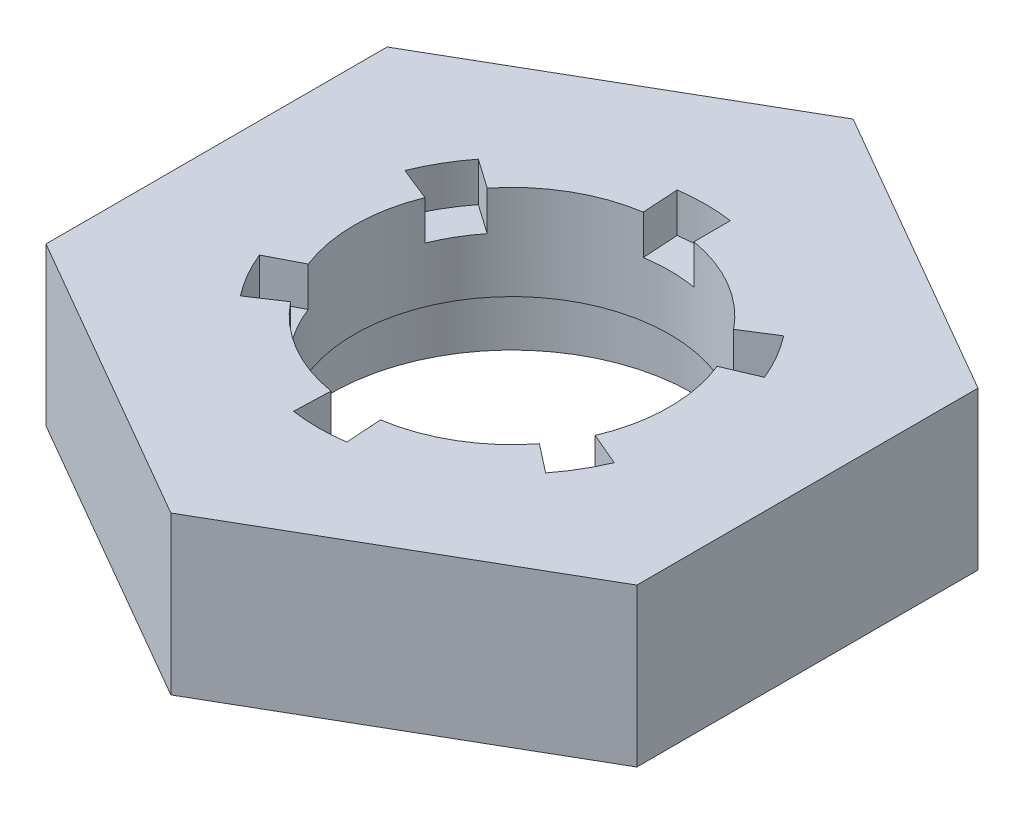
SolidWorks part; units mm, degrees
ref_plane "Front Plane" through (0, 0, 0) normal (0, 0, 1) x (1, 0, 0)
ref_plane "Top Plane" through (0, 0, 0) normal (0, 1, 0) x (1, 0, 0)
ref_plane "Right Plane" through (0, 0, 0) normal (1, 0, 0) x (0, 0, -1)
sketch "Sketch1" plane through (0, 0, 0) normal (0, 1, 0) x (1, 0, 0)
  line L0 (31.25, 32.475) -> (45.4247, 32.475)
  line L1 (75, 32.475) -> (75, 52.45)
  line L2 (75, 97.425) -> (68.75, 97.425)
  line L4 (0, 97.425) -> (0, 77.45)
  line L5 (0, 32.475) -> (6.25, 32.475)
  line L6 (56.25, 54.1247) -> (56.25, 75.7753)
  line L7 (18.75, 54.1247) -> (18.75, 75.7753)
  line L8 (0, 52.45) -> (0, 32.475)
  line L9 (18.75, 54.1247) -> (37.5, 43.2994)
  line L10 (37.5, 43.2994) -> (56.25, 54.1247)
  line L11 (56.25, 54.1247) -> (56.25, 75.7753)
  line L12 (56.25, 75.7753) -> (37.5, 86.6006)
  line L13 (37.5, 86.6006) -> (18.75, 75.7753)
  line L14 (18.75, 75.7753) -> (18.75, 54.1247)
  line L15 (68.75, 32.475) -> (75, 32.475)
  line L16 (75, 77.45) -> (75, 97.425)
  line L17 (43.75, 97.425) -> (31.25, 97.425)
  line L18 (6.25, 97.425) -> (0, 97.425)
  line L20 (29.1713, 39.3776) -> (17.9828, 44.9514)
  line L21 (56.25, 44.975) -> (45.4247, 38.725)
  line L28 (63.7858, 70.4718) -> (64.6108, 57.9991)
  line L38 (45.4247, 91.175) -> (56.25, 84.925)
  line L39 (18.75, 84.925) -> (29.5753, 91.175)
  line L45 (7.9042, 32.475) -> (7.9247, 32.475)
  line L49 (10.8253, 58.7) -> (10.8253, 71.2)
  circle A0 centre (37.5, 64.95) radius 10
  arc A3 (0, 52.45) -> (0, 77.45) centre (0, 64.95) ccw
  circle A4 centre (37.5, 64.95) radius 12.5
  arc A5 (75, 77.45) -> (75, 52.45) centre (75, 64.95) ccw
  arc A9 (6.25, 97.425) -> (31.25, 97.425) centre (18.75, 97.425) ccw
  arc A10 (43.75, 97.425) -> (68.75, 97.425) centre (56.25, 97.425) ccw
  arc A12 (31.25, 32.475) -> (6.25, 32.475) centre (18.75, 32.475) ccw
  arc A13 (68.75, 32.475) -> (43.75, 32.475) centre (56.25, 32.475) ccw
  circle A18 centre (18.75, -32.475) radius 12.5
  circle A19 centre (56.25, -32.475) radius 12.5
  circle A20 centre (93.75, -32.475) radius 12.5
  circle A21 centre (75, 0) radius 12.5
  circle A22 centre (37.5, 0) radius 12.5
  circle A23 centre (0, 0) radius 12.5
  circle A24 centre (0, 129.9) radius 12.5
  circle A25 centre (37.5, 129.9) radius 12.5
  circle A26 centre (75, 129.9) radius 12.5
  circle A27 centre (93.75, 97.425) radius 12.5
  circle A28 centre (93.75, 32.475) radius 12.5
  dimension "D1" = 3
  dimension "D3" = 3
  dimension "D2" = 3
  dimension "D4" = 3
extrude "Boss-Extrude6" add sketch "Sketch1" along normal blind 10 contours A4 A0 | L12 L13 L7 L9 L10 L6 A4
sketch "Sketch10" plane through (0, 0, 0) normal (0, -1, 0) x (1, 0, 0)
  circle A0 centre (37.5, -64.95) radius 11.5
extrude "Cut-Extrude2" cut sketch "Sketch10" against normal blind 4
sketch "Sketch13" plane through (0, 10, 0) normal (0, 1, 0) x (1, 0, 0)
  line L3 (48.8051, 60.1318) -> (46.6993, 61.0293)
  line L9 (47.1907, 57.3928) -> (45.3856, 58.8005)
  line L10 (35.9507, 74.8293) -> (35.8126, 77.1227)
  line L11 (74.8413, -35.9507) -> (77.1347, -35.8125)
  line L12 (39.1915, 74.8059) -> (39.1885, 77.1225)
  line L13 (74.818, -39.1914) -> (77.1512, -39.1885)
  line L14 (-35.9387, -74.8413) -> (-35.8005, -77.1347)
  line L15 (-39.1794, -74.818) -> (-39.1764, -77.1511)
  line L16 (-74.8292, 35.9387) -> (-77.1227, 35.8005)
  line L17 (-74.8059, 39.1794) -> (-77.1391, 39.1764)
  line L18 (74.8413, -35.9507) -> (77.1347, -35.8125)
  line L19 (74.818, -39.1914) -> (77.1512, -39.1885)
  line L20 (-35.9387, -74.8413) -> (-35.8005, -77.1347)
  line L21 (-39.1794, -74.818) -> (-39.1764, -77.1511)
  line L22 (-74.8292, 35.9387) -> (-77.1227, 35.8005)
  line L23 (-74.8059, 39.1794) -> (-77.1391, 39.1764)
  line L24 (-74.8293, 35.9507) -> (-77.1227, 35.8126)
  line L25 (-74.8059, 39.1915) -> (-77.1391, 39.1885)
  line L26 (-35.9507, -74.8293) -> (-35.8126, -77.1227)
  line L27 (-39.1915, -74.8059) -> (-39.1885, -77.1391)
  line L28 (74.8293, -35.9507) -> (77.1227, -35.8126)
  line L29 (74.8059, -39.1915) -> (77.1391, -39.1885)
  line L30 (47.21, 72.4825) -> (45.2645, 71.2517)
  line L31 (48.8783, 69.5928) -> (46.7714, 68.6971)
  arc A0 (39.1885, 77.1225) -> (35.8126, 77.1227) centre (37.5, 64.95) ccw
  arc A1 (27.8554, 72.4706) -> (27.807, 72.5044) centre (26.8532, 71.0874) ccw
  arc A4 (26.105, 69.5518) -> (26.1403, 69.5351) centre (26.8532, 71.0874) ccw
  arc A5 (35.8001, 52.779) -> (39.1876, 52.7773) centre (37.5, 64.95) ccw
  arc A6 (48.8051, 60.1318) -> (48.72, 60.1681) centre (48.1361, 58.6799) ccw
  arc A7 (27.776, 57.4357) -> (27.807, 57.4587) centre (26.8075, 58.7767) ccw
  circle A8 centre (37.5, 64.95) radius 10
  arc A10 (27.807, 72.5044) -> (26.105, 69.5518) centre (37.5, 64.95) ccw
  arc A12 (77.1346, -39.1885) -> (77.1347, -35.8125) centre (64.9621, -37.5) ccw
  circle A13 centre (64.9621, -37.5) radius 10
  arc A14 (-39.1764, -77.1346) -> (-35.8005, -77.1347) centre (-37.4879, -64.962) ccw
  circle A15 centre (-37.4879, -64.962) radius 10
  arc A16 (-77.1225, 39.1765) -> (-77.1227, 35.8005) centre (-64.95, 37.4879) ccw
  circle A17 centre (-64.95, 37.4879) radius 10
  arc A18 (77.1346, -39.1885) -> (77.1347, -35.8125) centre (64.9621, -37.5) ccw
  circle A19 centre (64.9621, -37.5) radius 10
  arc A20 (-39.1764, -77.1346) -> (-35.8005, -77.1347) centre (-37.4879, -64.962) ccw
  circle A21 centre (-37.4879, -64.962) radius 10
  arc A22 (-77.1225, 39.1765) -> (-77.1227, 35.8005) centre (-64.95, 37.4879) ccw
  circle A23 centre (-64.95, 37.4879) radius 10
  arc A24 (-77.1225, 39.1885) -> (-77.1227, 35.8126) centre (-64.95, 37.5) ccw
  arc A25 (-39.1885, -77.1225) -> (-35.8126, -77.1227) centre (-37.5, -64.95) ccw
  arc A26 (77.1225, -39.1885) -> (77.1227, -35.8126) centre (64.95, -37.5) ccw
  arc A29 (48.8783, 69.5928) -> (47.21, 72.4825) centre (37.5, 64.95) ccw
  arc A30 (48.8189, 69.5676) -> (48.8783, 69.5928) centre (48.1925, 71.1233) ccw
  arc A32 (47.1898, 57.3916) -> (48.8051, 60.1318) centre (37.5, 64.95) ccw
  arc A33 (35.8082, 52.8641) -> (35.8001, 52.779) centre (37.5, 52.6609) ccw
  arc A35 (26.1297, 60.2875) -> (27.776, 57.4357) centre (37.5, 64.95) ccw
  spline S0 degree 2 poles (26.1297, 60.2875) (27.1519, 60.8141) (28.1741, 61.3407) knots 0.055334 0.055334 0.055334 1 1 1
  spline S1 degree 2 poles (35.8053, 52.7783) (35.8437, 53.93) (35.882, 55.0818) knots 0.082683 0.082683 0.082683 1 1 1
  spline S3 degree 1 poles (27.807, 57.4587) (29.6868, 58.7087) knots 0 0 1 1
  spline S4 degree 1 poles (27.807, 72.5044) (29.6868, 71.1913) knots 0 0 1 1
  spline S5 degree 1 poles (26.1403, 69.5351) (28.2286, 68.6971) knots 0 0 1 1
  spline S6 degree 2 poles (39.1876, 52.7773) (39.1102, 53.9228) (39.0328, 55.0682) knots 0.08274 0.08274 0.08274 1 1 1
  point P5 (0, 0)
  dimension "D1" = 4
  dimension "D2" = 4
  dimension "D3" = 4
extrude "Cut-Extrude5" cut sketch "Sketch13" against normal blind 2.5 contours A4 S5 S4 A10 M1 | L12 A0 L10 M1 | L31 A29 L30 M1 | L9 A32 L3 M1 | A5 S6 A8 S1 | A7 S3 S0 A35 M1
